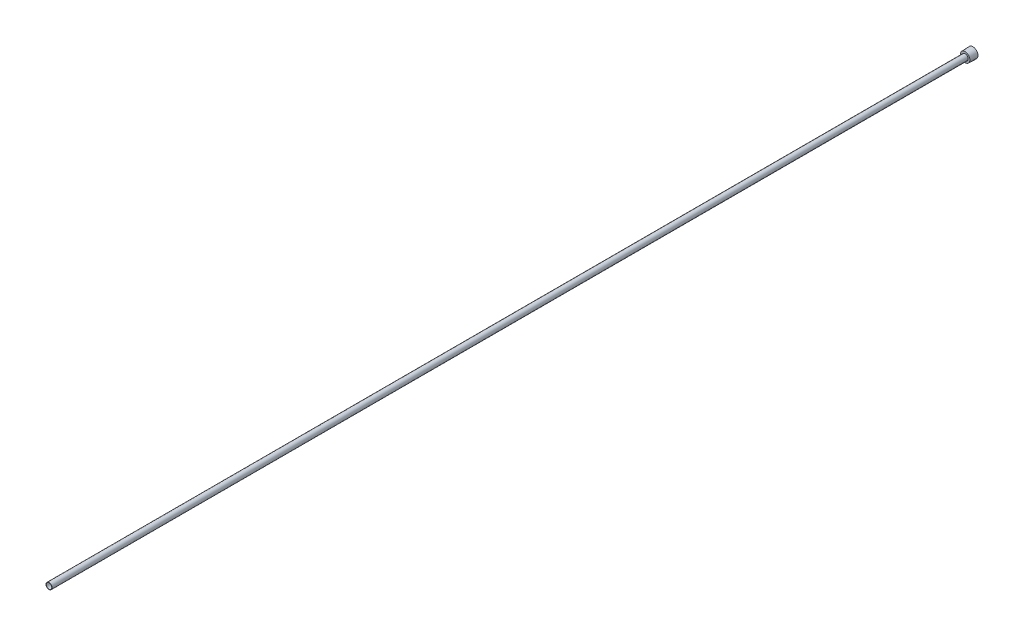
SolidWorks part; units mm, degrees
ref_plane "Front Plane" through (0, 0, 0) normal (0, 0, 1) x (1, 0, 0)
ref_plane "Top Plane" through (0, 0, 0) normal (0, 1, 0) x (1, 0, 0)
ref_plane "Right Plane" through (0, 0, 0) normal (1, 0, 0) x (0, 0, -1)
sketch "Sketch1" plane through (0, 0, 0) normal (1, 0, 0) x (0, 0, -1)
  line L0 (-331.1242, 0) -> (49668.8758, 0) construction
  line L1 (0, 0) -> (-1219.2, 0)
  line L6 (0, 0) -> (0, 6.7183)
  line L7 (0, 6.7183) -> (-10.3124, 6.3421)
  line L8 (-10.3124, 3.9688) -> (-1219.2, 3.9687)
  line L9 (-10.3124, 6.3421) -> (-10.3124, 3.9688)
  line L10 (-1219.2, 3.9687) -> (-1219.2, 0)
  dimension "D1" = 7.9375
  dimension "D2" = 10.3124
  dimension "D3" = 2.089
  dimension "D4" = 13.4366
  dimension "D5" = 1219.2
revolve "Revolve1" add sketch "Sketch1" angle 360 about L0
sketch "Sketch2" plane through (0, 0, 1219.2) normal (0, 0, 1) x (1, 0, 0)
  circle A0 centre (0, 0) radius 3.6512
  dimension "D1" = 7.3025
extrude "Cut-Extrude1" cut sketch "Sketch2" against normal through all
sketch "Sketch3" plane through (0, 0, 0) normal (0, 0, -1) x (-1, 0, 0)
  line L0 (0, 7.3901) -> (0, -7.3901) construction
  line L1 (-4.7625, -2.7496) -> (0, -5.4993)
  line L2 (0, -5.4993) -> (4.7625, -2.7496)
  line L3 (4.7625, -2.7496) -> (4.7625, 2.7496)
  line L4 (4.7625, 2.7496) -> (0, 5.4993)
  line L5 (0, 5.4993) -> (-4.7625, 2.7496)
  line L6 (-4.7625, 2.7496) -> (-4.7625, -2.7496)
  circle A0 centre (0, 0) radius 4.7625 construction
  dimension "D1" = 9.525
extrude "Cut-Extrude2" cut sketch "Sketch3" against normal blind 6.35
